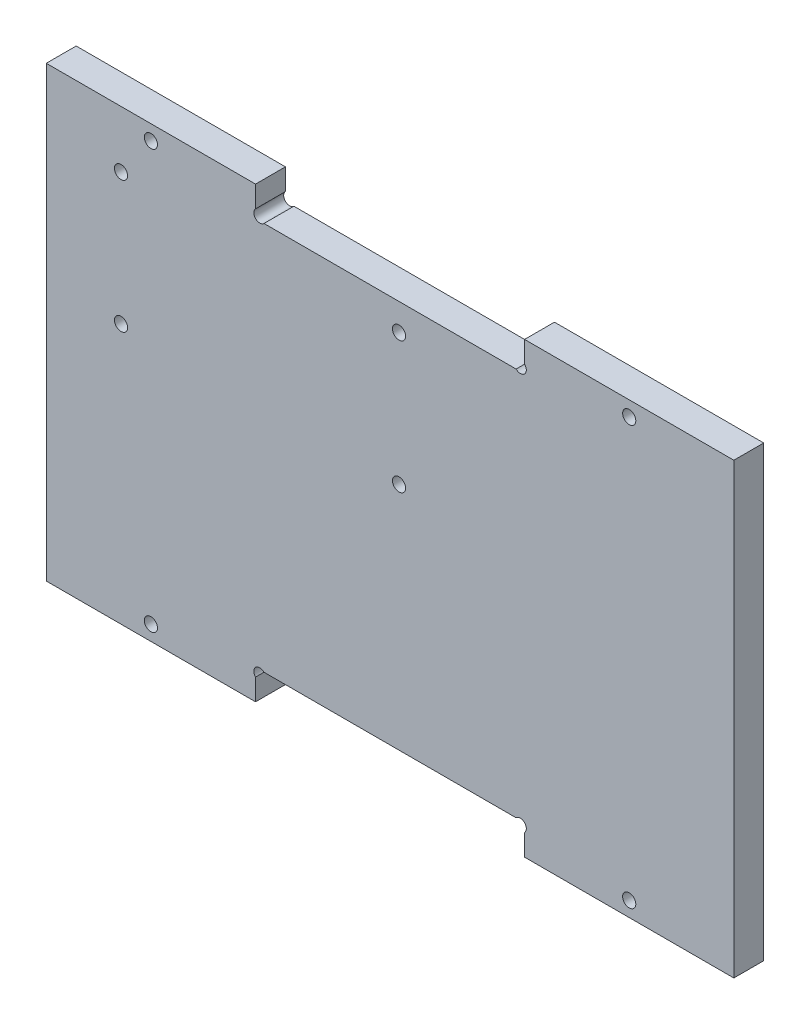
SolidWorks part; units mm, degrees
ref_plane "Plan de face" through (0, 0, 0) normal (0, 0, 1) x (1, 0, 0)
ref_plane "Plan de dessus" through (0, 0, 0) normal (0, 1, 0) x (1, 0, 0)
ref_plane "Plan de droite" through (0, 0, 0) normal (1, 0, 0) x (0, 0, -1)
sketch "Esquisse1" plane through (0, 0, 0) normal (0, 0, 1) x (1, 0, 0)
  line L1 (0, 0) -> (115, 0)
  line L2 (0, 0) -> (0, 75)
  line L3 (0, 75) -> (115, 75)
  line L4 (115, 0) -> (115, 75)
  dimension "D1" = 115
  dimension "D2" = 75
extrude "Boss.-Extru.1" add sketch "Esquisse1" along normal blind 5
sketch "Esquisse2" plane through (0, 0, 5) normal (0, 0, 1) x (1, 0, 0)
  line L0 (115, 75) -> (0, 75) construction
  line L1 (0, 75) -> (0, 0) construction
  circle A0 centre (4.75, 65.25) radius 1.1
  circle A1 centre (4.75, 10.25) radius 1.1
  circle A2 centre (98.05, 65.25) radius 1.1
  dimension "D2" = 55
  dimension "D5" = 2.2
  dimension "D6" = 2.2
  dimension "D7" = 2.2
  dimension "D1" = 93.3
  dimension "D3" = 9.75
  dimension "D4" = 4.75
extrude "Enlèv. mat.-Extru.1" [suppressed] cut sketch "Esquisse2" against normal up to next
sketch "Esquisse3" plane through (0, 0, 5) normal (0, 0, 1) x (1, 0, 0)
  line L0 (115, 75) -> (0, 75) construction
  line L1 (0, 75) -> (0, 0) construction
  circle A0 centre (12.5, 65.5) radius 1.1
  circle A1 centre (59, 65.5) radius 1.1
  circle A2 centre (59, 43.5) radius 1.1
  circle A3 centre (12.5, 43.5) radius 1.1
  dimension "D1" = 2.2
  dimension "D2" = 2.2
  dimension "D3" = 2.2
  dimension "D4" = 2.2
  dimension "D5" = 46.5
  dimension "D6" = 22
  dimension "D7" = 9.5
  dimension "D8" = 12.5
extrude "Enlèv. mat.-Extru.2" cut sketch "Esquisse3" against normal up to next
sketch "Esquisse5" [suppressed] plane through (0, 0, 0) normal (0, 0, -1) x (-1, 0, 0)
  circle A0 centre (-98.05, 65.25) radius 2
  circle A1 centre (-4.75, 10.25) radius 2
  circle A2 centre (-4.75, 65.25) radius 2
  dimension "D1" = 4
  dimension "D2" = 4
  dimension "D3" = 4
extrude "Enlèv. mat.-Extru.3" [suppressed] cut sketch "Esquisse5" against normal blind 1.5
sketch "Esquisse6" plane through (0, 0, 0) normal (0, 0, -1) x (-1, 0, 0)
  line L0 (-115, 75) -> (0, 75) construction
  line L1 (-80, 75) -> (-35, 75)
  line L2 (-80, 75) -> (-80, 70)
  line L3 (-80, 70) -> (-35, 70)
  line L4 (-35, 75) -> (-35, 70)
  line L5 (-115, 0) -> (-115, 75) construction
  line L6 (0, 0) -> (-115, 0) construction
  line L7 (-80, 0) -> (-35, 0)
  line L8 (-80, 0) -> (-80, 5)
  line L9 (-80, 5) -> (-35, 5)
  line L10 (-35, 0) -> (-35, 5)
  dimension "D1" = 5
  dimension "D2" = 45
  dimension "D3" = 35
  dimension "D4" = 45
  dimension "D5" = 5
  dimension "D6" = 35
extrude "Enlèv. mat.-Extru.4" cut sketch "Esquisse6" against normal up to next
sketch "Esquisse7" plane through (0, 0, 0) normal (0, 0, -1) x (-1, 0, 0)
  line L0 (-80, 70) -> (-64.4144, 85.5856) construction
  line L1 (-35, 70) -> (-47.5155, 82.5155) construction
  line L2 (-35, 5) -> (-48.0935, -8.0935) construction
  line L3 (-80, 5) -> (-65.1639, -9.8361) construction
  line L4 (-80, 70) -> (-35, 70) construction
  line L5 (-35, 5) -> (-80, 5) construction
  circle A0 centre (-35.7071, 70.7071) radius 1
  circle A1 centre (-79.2929, 70.7071) radius 1
  circle A2 centre (-79.2929, 4.2929) radius 1
  circle A3 centre (-35.7071, 4.2929) radius 1
  dimension "D5" = 2
  dimension "D6" = 2
  dimension "D7" = 2
  dimension "D8" = 2
  dimension "D1" = 45
  dimension "D2" = 45
  dimension "D3" = 45
  dimension "D4" = 45
extrude "Enlèv. mat.-Extru.5" cut sketch "Esquisse7" against normal up to next
ref_plane "Plan1" through (0, 37.5, 0) normal (0, 1, 0) x (-1, 0, 0)
ref_plane "Plan2" through (57.5, 0, 0) normal (1, 0, 0) x (0, 0, -1)
sketch "Esquisse8" plane through (0, 0, 0) normal (0, 0, -1) x (-1, 0, 0)
  line L0 (-35, 75) -> (0, 75) construction
  line L1 (-17.5, 75) -> (-17.5, 57.6403) construction
  circle A0 centre (-17.5, 72.5) radius 1.1
  dimension "D1" = 2.2
  dimension "D2" = 2.5
extrude "Enlèv. mat.-Extru.6" cut sketch "Esquisse8" against normal up to next
mirror "Symétrie1" about plane through (57.5, 0, 0) normal (1, 0, 0) of "Enlèv. mat.-Extru.6"
mirror "Symétrie2" about plane through (0, 37.5, 0) normal (0, 1, 0) of "Symétrie1", "Enlèv. mat.-Extru.6"
